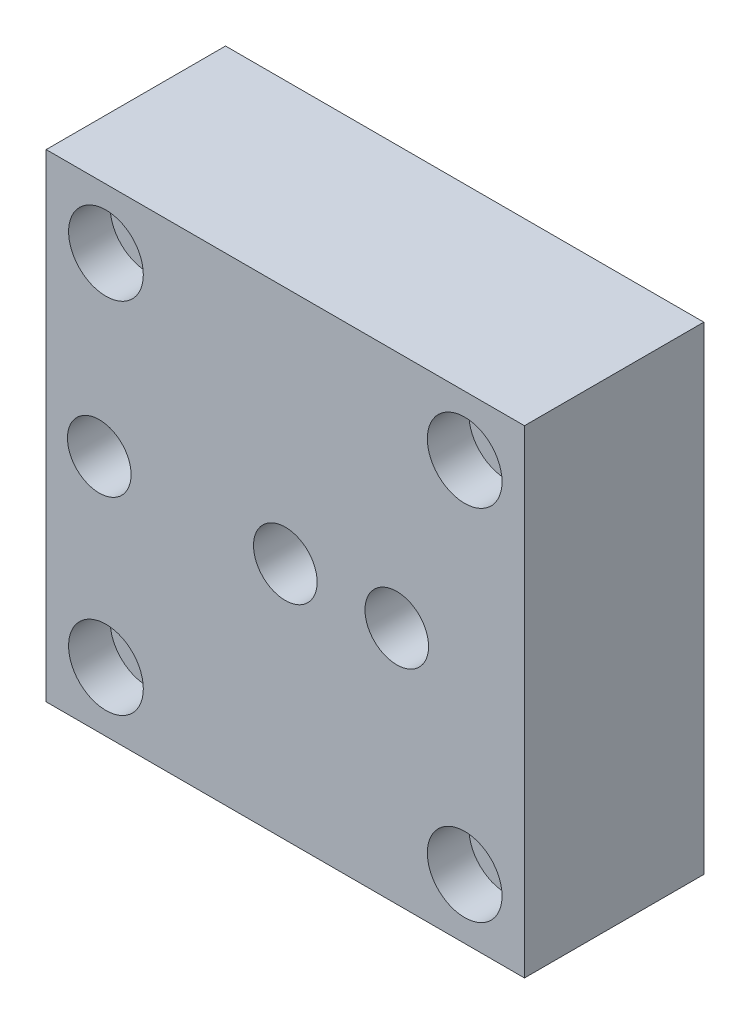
SolidWorks part; units mm, degrees
ref_plane "Front Plane" through (0, 0, 0) normal (0, 0, 1) x (1, 0, 0)
ref_plane "Top Plane" through (0, 0, 0) normal (0, 1, 0) x (1, 0, 0)
ref_plane "Right Plane" through (0, 0, 0) normal (1, 0, 0) x (0, 0, -1)
sketch "Sketch1" plane through (0, 0, 0) normal (0, 0, 1) x (1, 0, 0)
  line L1 (-25.4, 25.4) -> (25.4, 25.4)
  line L2 (-25.4, 25.4) -> (-25.4, -25.4)
  line L3 (-25.4, -25.4) -> (25.4, -25.4)
  line L4 (25.4, 25.4) -> (25.4, -25.4)
  line L5 (-25.4, 25.4) -> (25.4, -25.4) construction
  line L6 (-25.4, -25.4) -> (25.4, 25.4) construction
  point P0 (0, 0)
  dimension "D1" = 50.8
  dimension "D2" = 50.8
extrude "Boss-Extrude1" add sketch "Sketch1" along normal blind 19.05
sketch "Sketch2" plane through (0, 0, 19.05) normal (0, 0, 1) x (1, 0, 0)
  line L0 (0, 25.4) -> (0, -25.4) construction
  line L3 (-25.4, 25.4) -> (-25.4, -25.4) construction
  line L7 (25.4, 25.4) -> (-25.4, 25.4) construction
  line L8 (-25.4, -25.4) -> (25.4, -25.4) construction
  line L9 (-25.4, 0) -> (25.4, 0) construction
  line L10 (25.4, -25.4) -> (25.4, 25.4) construction
  circle A1 centre (-19.05, 19.05) radius 1.5875 construction
  circle A2 centre (19.05, 19.05) radius 1.5875 construction
  circle A3 centre (19.05, -19.05) radius 1.5875 construction
  circle A4 centre (-19.05, -19.05) radius 1.5875 construction
  dimension "D2" = 3.175
  dimension "D3" = 6.35
  dimension "D4" = 6.35
hole_wizard "CBORE for #8 Binding Head Machine Screw1" positions "Sketch3" profile "Sketch4" counterbore size "#8" standard "ANSI Inch"
sketch "Sketch3" plane through (0, 0, 19.05) normal (0, 0, 1) x (1, 0, 0)
  point P0 (-19.05, 19.05)
  point P3 (19.05, 19.05)
  point P6 (-19.05, -19.05)
  point P9 (19.05, -19.05)
sketch "Sketch4" plane through (-19.05, 19.05, 19.05) normal (1, 0, 0) x (0, -1, 0)
  line L0 (0, 0) -> (0, 19.05)
  line L1 (0, 19.05) -> (2.1526, 19.05)
  line L3 (2.1526, 19.05) -> (2.1527, 4.4196)
  line L4 (2.1527, 4.4196) -> (3.9687, 4.4196)
  line L5 (3.9687, 4.4196) -> (3.9687, 0)
  line L7 (3.9687, 0) -> (0, 0)
  line L11 (0, -6.35) -> (0, 107.95) construction
  dimension "Thru Hole Dia." = 4.3053
  dimension "Thru Hole Depth" = 19.05
  dimension "C'Bore Dia." = 7.9375
  dimension "C'Bore Depth" = 4.4196
sketch "Sketch5" plane through (0, 0, 19.05) normal (0, 0, 1) x (1, 0, 0)
  circle A0 centre (0, 0) radius 3.3782
  dimension "D1" = 6.7564
extrude "Cut-Extrude1" cut sketch "Sketch5" against normal through all
sketch "Sketch8" plane through (0, 0, 19.05) normal (0, 0, 1) x (1, 0, 0)
  line L0 (0, 0) -> (-341.8241, 0) construction
  circle A0 centre (-222.7072, 0) radius 222.7072 construction
  circle A1 centre (-222.7072, 0) radius 202.946 construction
  circle A2 centre (-222.7072, 0) radius 234.5436 construction
  circle A3 centre (-19.7612, 0) radius 3.3782
  circle A4 centre (11.8364, 0) radius 3.3782
  dimension "D1" = 445.4144
  dimension "D2" = 469.0872
  dimension "D3" = 405.892
  dimension "D4" = 6.7564
  dimension "D5" = 6.7564
extrude "Cut-Extrude3" cut sketch "Sketch8" against normal through all
